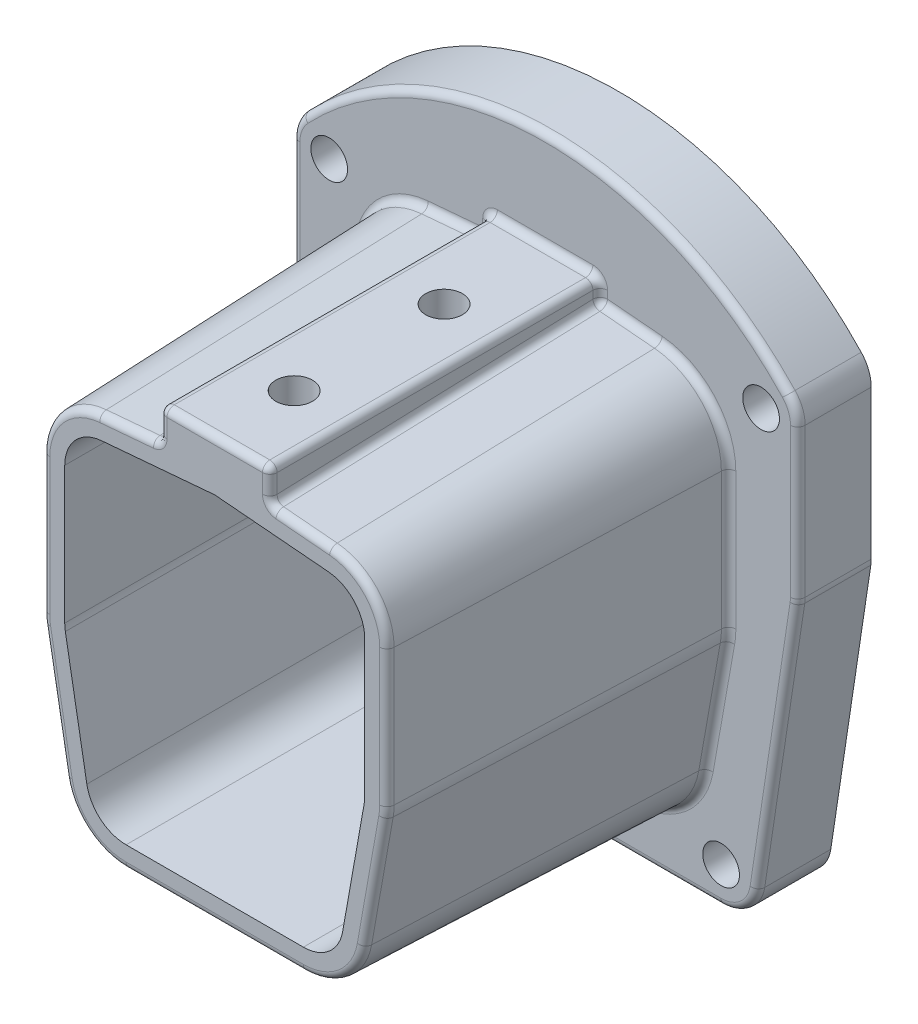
SolidWorks part; units mm, degrees
ref_plane "Plan de face" through (0, 0, 0) normal (0, 0, 1) x (1, 0, 0)
ref_plane "Plan de dessus" through (0, 0, 0) normal (0, 1, 0) x (1, 0, 0)
ref_plane "Plan de droite" through (0, 0, 0) normal (1, 0, 0) x (0, 0, -1)
sketch "Esquisse1" plane through (0, 0, 0) normal (0, 0, 1) x (1, 0, 0)
  line L0 (0, 81.7634) -> (0, -68.113) construction
  line L1 (0, 59.8685) -> (-31.7104, 57.1467)
  line L2 (-50, 37.22) -> (-50, 0)
  line L3 (-49.6934, -3.4884) -> (-43.8355, -36.5581)
  line L4 (-24.1421, -53.0696) -> (24.1421, -53.0696)
  line L5 (49.6934, -3.4884) -> (43.8355, -36.5581)
  line L6 (50, 37.22) -> (50, 0)
  line L7 (0, 59.8685) -> (31.7104, 57.1467)
  arc A0 (-24.1421, -53.0696) -> (-43.8355, -36.5581) centre (-24.1421, -33.0696) cw
  arc A1 (-49.6934, -3.4884) -> (-50, 0) centre (-30, 0) cw
  arc A2 (-50, 37.22) -> (-31.7104, 57.1467) centre (-30, 37.22) cw
  arc A3 (24.1421, -53.0696) -> (43.8355, -36.5581) centre (24.1421, -33.0696) ccw
  arc A4 (49.6934, -3.4884) -> (50, 0) centre (30, 0) ccw
  arc A5 (50, 37.22) -> (31.7104, 57.1467) centre (30, 37.22) ccw
  point P15 (0, -53.0696)
  dimension "D1" = 20
  dimension "D2" = 100
extrude "Boss.-Extru.1" add sketch "Esquisse1" along normal blind 90 draft 2
sketch "Esquisse3" plane through (0, 0, 0) normal (0, 0, -1) x (-1, 0, 0)
  line L0 (0, 91.9147) -> (0, -85.0361) construction
  line L1 (-68.8142, 55.5099) -> (-68.8142, 14.9392)
  line L2 (-68.703, 13.4522) -> (-57.8061, -59.0124)
  line L3 (-47.9173, -67.5253) -> (47.9173, -67.5253)
  line L4 (68.703, 13.4522) -> (57.8061, -59.0124)
  line L5 (68.8142, 55.5099) -> (68.8142, 14.9392)
  arc A0 (66.0866, 62.3737) -> (-66.0866, 62.3737) centre (0, 0) ccw
  arc A1 (-47.9173, -67.5253) -> (-57.8061, -59.0124) centre (-47.9173, -57.5253) cw
  arc A2 (-68.703, 13.4522) -> (-68.8142, 14.9392) centre (-58.8142, 14.9392) cw
  arc A3 (-68.8142, 55.5099) -> (-66.0866, 62.3737) centre (-58.8142, 55.5099) cw
  arc A4 (47.9173, -67.5253) -> (57.8061, -59.0124) centre (47.9173, -57.5253) ccw
  arc A5 (68.703, 13.4522) -> (68.8142, 14.9392) centre (58.8142, 14.9392) ccw
  arc A6 (68.8142, 55.5099) -> (66.0866, 62.3737) centre (58.8142, 55.5099) ccw
  point P16 (0, -67.5253)
  dimension "D1" = 10
extrude "Boss.-Extru.2" add sketch "Esquisse3" along normal blind 20
sketch "Esquisse2" plane through (0, 0, 90) normal (0, 0, 1) x (1, 0, 0)
  line L14 (30.9285, 48.0373) -> (0, 50.692)
  line L15 (0, 50.692) -> (-30.9285, 48.0373)
  line L16 (-40.8571, 37.22) -> (-40.8571, 0)
  line L17 (-40.6907, -1.8937) -> (-34.8328, -34.9633)
  line L18 (-24.1421, -43.9267) -> (24.1421, -43.9267)
  line L19 (34.8328, -34.9633) -> (40.6907, -1.8937)
  line L20 (40.8571, 0) -> (40.8571, 37.22)
  line L21 (30.9285, 48.0373) -> (0, 50.692)
  line L22 (0, 50.692) -> (-30.9285, 48.0373)
  line L23 (-40.8571, 37.22) -> (-40.8571, 0)
  line L24 (-40.6907, -1.8937) -> (-34.8328, -34.9633)
  line L25 (-24.1421, -43.9267) -> (24.1421, -43.9267)
  line L26 (34.8328, -34.9633) -> (40.6907, -1.8937)
  line L27 (40.8571, 0) -> (40.8571, 37.22)
  arc A12 (-30.9285, 48.0373) -> (-40.8571, 37.22) centre (-30, 37.22) ccw
  arc A13 (-40.8571, 0) -> (-40.6907, -1.8937) centre (-30, 0) ccw
  arc A14 (-34.8328, -34.9633) -> (-24.1421, -43.9267) centre (-24.1421, -33.0696) ccw
  arc A15 (24.1421, -43.9267) -> (34.8328, -34.9633) centre (24.1421, -33.0696) ccw
  arc A16 (40.6907, -1.8937) -> (40.8571, 0) centre (30, 0) ccw
  arc A17 (40.8571, 37.22) -> (30.9285, 48.0373) centre (30, 37.22) ccw
  arc A18 (-30.9285, 48.0373) -> (-40.8571, 37.22) centre (-30, 37.22) ccw
  arc A19 (-40.8571, 0) -> (-40.6907, -1.8937) centre (-30, 0) ccw
  arc A20 (-34.8328, -34.9633) -> (-24.1421, -43.9267) centre (-24.1421, -33.0696) ccw
  arc A21 (24.1421, -43.9267) -> (34.8328, -34.9633) centre (24.1421, -33.0696) ccw
  arc A22 (40.6907, -1.8937) -> (40.8571, 0) centre (30, 0) ccw
  arc A23 (40.8571, 37.22) -> (30.9285, 48.0373) centre (30, 37.22) ccw
  dimension "D1" = 6
extrude "Enlèv. mat.-Extru.1" cut sketch "Esquisse2" against normal through all
sketch "Esquisse4" plane through (0, 0, 0) normal (0, 0, 1) x (1, 0, 0)
  line L0 (0, 74.0796) -> (0, 37.9955) construction
  line L1 (-15, 64.4407) -> (15, 64.4407)
  line L2 (-15, 64.4407) -> (-15, 53.0717)
  line L3 (-15, 53.0717) -> (15, 53.0717)
  line L4 (15, 64.4407) -> (15, 53.0717)
  dimension "D1" = 30
  dimension "D2" = 15
extrude "Boss.-Extru.3" add sketch "Esquisse4" along normal up to surface (90 mm away)
fillet "Congé1" radius 2 48 edges at (15, 61.5108, 0) (-15, 59.9336, 90) (15, 59.9336, 90) (0, 64.4407, 0) (-23.3552, 57.8638, 0) (-23.2208, 54.7209, 90) (-44.7344, 50.7439, 0) (-42.419, 48.6187, 90) (-50, 18.61, 0) (-46.8571, 18.61, 90) (-49.9232, -1.7509, 0) (-46.7924, -1.4758, 90) (-46.7645, -20.0233, 0) (-43.6698, -19.4751, 90) (-36.9918, -48.3956, 0) (-34.9726, -45.9872, 90) (0, -53.0696, 0) (0, -49.9267, 90) (36.9918, -48.3956, 0) (34.9726, -45.9872, 90) (46.7645, -20.0233, 0) (43.6698, -19.4751, 90) (49.9232, -1.7509, 0) (46.7924, -1.4758, 90) (50, 18.61, 0) (46.8571, 18.61, 90) (23.2208, 54.7209, 90) (23.3552, 57.8638, 0) (44.7344, 50.7439, 0) (-68.1073, 59.2028, 0) (-68.8142, 35.2245, 0) (-68.7864, 14.1936, 0) (-63.2546, -22.7801, 0) (-54.4414, -65.1039, 0) (0, -67.5253, 0) (54.4414, -65.1039, 0) (63.2546, -22.7801, 0) (68.7864, 14.1936, 0) (68.8142, 35.2245, 0) (68.1073, 59.2028, 0) (-15, 61.5108, 0) (0, 64.4407, 90) (-15, 64.4407, 45) (15, 64.4407, 45) (42.419, 48.6187, 90) (15, 57.0038, 45) (-15, 57.0038, 45) (0, 90.8731, 0)
hole_wizard "Diamètre du perçage Ø10.0 (10)1" positions "Esquisse6" profile "Esquisse5" hole size "Ø10.0" standard "ISO"
sketch "Esquisse6" plane through (0, 64.4407, 0) normal (0, 1, 0) x (-1, 0, 0)
  line L0 (0, -9.3675) -> (0, 93.9565) construction
  point P0 (0, 27.5431)
  point P1 (0, 68.3733)
sketch "Esquisse5" plane through (0, 64.4407, 27.5431) normal (1, 0, 0) x (0, 0, 1)
  line L0 (0, 0) -> (0, 56.7543)
  line L1 (0, 56.7543) -> (5, 53.75)
  line L2 (5, 53.75) -> (5, 0)
  line L5 (5, 0) -> (0, 0)
  line L10 (0, 56.7543) -> (-5, 53.75) construction
  line L11 (0, -6.35) -> (0, 107.95) construction
  dimension "Diamètre du perçage" = 10
  dimension "Profondeur du perçage" = 53.75
  dimension "Angle de pointe" = 118
hole_wizard "Diamètre du perçage Ø10.0 (10)2" positions "Esquisse8" profile "Esquisse7" hole size "Ø10.0" standard "ISO"
sketch "Esquisse8" plane through (0, 0, 0) normal (0, 0, 1) x (1, 0, 0)
  arc A0 (-66.0866, 62.3737) -> (-68.8142, 55.5099) centre (-58.8142, 55.5099) ccw construction
  arc A1 (-57.8061, -59.0124) -> (-47.9173, -67.5253) centre (-47.9173, -57.5253) ccw construction
  point P0 (-47.9173, -57.5253)
  point P1 (-58.8142, 55.5099)
sketch "Esquisse7" plane through (-47.9173, -57.5253, 0) normal (1, 0, 0) x (0, -1, 0)
  line L0 (0, 0) -> (0, 20.001)
  line L1 (0, 20.001) -> (5, 20.001)
  line L2 (5, 20.001) -> (5, 0)
  line L5 (5, 0) -> (0, 0)
  line L11 (0, -6.35) -> (0, 107.95) construction
  dimension "Diamètre du perçage jusqu'au prochain" = 10
  dimension "Profondeur du perçage jusqu'au prochain" = 20.001
mirror "Symétrie1" about plane through (0, 0, 0) normal (1, 0, 0) of "Diamètre du perçage Ø10.0 (10)2"
sketch "Esquisse9" plane through (0, 0, -20) normal (0, 0, -1) x (-1, 0, 0)
  line L0 (-15, -56.979) -> (15, -56.979) construction
  line L1 (-15, -50.979) -> (15, -50.979)
  line L2 (-15, -62.979) -> (15, -62.979)
  line L3 (0, 96.076) -> (0, -73.7169) construction
  line L4 (-53.2406, -5.2035) -> (-47.7694, -34.7003) construction
  line L5 (-47.3412, -4.1092) -> (-41.87, -33.6061)
  line L6 (-59.14, -6.2977) -> (-53.6688, -35.7946)
  line L7 (-56.0381, 43.5136) -> (-56.0381, 13.5136) construction
  line L8 (-50.0381, 43.5136) -> (-50.0381, 13.5136)
  line L9 (-62.0381, 43.5136) -> (-62.0381, 13.5136)
  line L10 (-41.7189, 63.9909) -> (-12.8834, 72.2682) construction
  line L11 (-43.3744, 69.758) -> (-14.5389, 78.0353)
  line L12 (-40.0634, 58.2238) -> (-11.2279, 66.5011)
  line L13 (53.2406, -5.2035) -> (47.7694, -34.7003) construction
  line L14 (47.3412, -4.1092) -> (41.87, -33.6061)
  line L15 (59.14, -6.2977) -> (53.6688, -35.7946)
  line L16 (56.0381, 43.5136) -> (56.0381, 13.5136) construction
  line L17 (50.0381, 43.5136) -> (50.0381, 13.5136)
  line L18 (62.0381, 43.5136) -> (62.0381, 13.5136)
  line L19 (41.7189, 63.9909) -> (12.8834, 72.2682) construction
  line L20 (43.3744, 69.758) -> (14.5389, 78.0353)
  line L21 (40.0634, 58.2238) -> (11.2279, 66.5011)
  arc A0 (-15, -50.979) -> (-15, -62.979) centre (-15, -56.979) ccw
  arc A1 (15, -62.979) -> (15, -50.979) centre (15, -56.979) ccw
  arc A2 (-47.3412, -4.1092) -> (-59.14, -6.2977) centre (-53.2406, -5.2035) ccw
  arc A3 (-53.6688, -35.7946) -> (-41.87, -33.6061) centre (-47.7694, -34.7003) ccw
  arc A4 (-50.0381, 43.5136) -> (-62.0381, 43.5136) centre (-56.0381, 43.5136) ccw
  arc A5 (-62.0381, 13.5136) -> (-50.0381, 13.5136) centre (-56.0381, 13.5136) ccw
  arc A6 (-43.3744, 69.758) -> (-40.0634, 58.2238) centre (-41.7189, 63.9909) ccw
  arc A7 (-11.2279, 66.5011) -> (-14.5389, 78.0353) centre (-12.8834, 72.2682) ccw
  arc A8 (47.3412, -4.1092) -> (59.14, -6.2977) centre (53.2406, -5.2035) cw
  arc A9 (53.6688, -35.7946) -> (41.87, -33.6061) centre (47.7694, -34.7003) cw
  arc A10 (50.0381, 43.5136) -> (62.0381, 43.5136) centre (56.0381, 43.5136) cw
  arc A11 (62.0381, 13.5136) -> (50.0381, 13.5136) centre (56.0381, 13.5136) cw
  arc A12 (43.3744, 69.758) -> (40.0634, 58.2238) centre (41.7189, 63.9909) cw
  arc A13 (11.2279, 66.5011) -> (14.5389, 78.0353) centre (12.8834, 72.2682) cw
  point P2 (0, -56.979)
  point P12 (-50.505, -19.9519)
  point P19 (-56.0381, 28.5136)
  point P26 (-27.3011, 68.1295)
  point P33 (50.505, -19.9519)
  point P40 (56.0381, 28.5136)
  point P47 (27.3011, 68.1295)
  dimension "D1" = 6
  dimension "D2" = 30
  dimension "D3" = 6
  dimension "D4" = 6
  dimension "D5" = 6
  dimension "D6" = 30
  dimension "D7" = 30
  dimension "D8" = 30
extrude "Enlèv. mat.-Extru.2" cut sketch "Esquisse9" against normal blind 14
fillet "Congé2" radius 2 28 edges at (50.0381, 28.5136, -6) (56.0381, 7.5136, -6) (62.0381, 28.5136, -6) (56.0381, 49.5136, -6) (44.6056, -18.8577, -6) (46.6751, -40.5997, -6) (56.4044, -21.0461, -6) (54.3348, 0.6959, -6) (0, -50.979, -6) (-21, -56.979, -6) (0, -62.979, -6) (21, -56.979, -6) (-56.4044, -21.0461, -6) (-46.6751, -40.5997, -6) (-44.6056, -18.8577, -6) (-54.3348, 0.6959, -6) (-62.0381, 28.5136, -6) (-56.0381, 7.5136, -6) (-50.0381, 28.5136, -6) (-56.0381, 49.5136, -6) (-25.6457, 62.3624, -6) (-7.1163, 73.9237, -6) (-28.9566, 73.8966, -6) (-47.486, 62.3354, -6) (28.9566, 73.8966, -6) (7.1163, 73.9237, -6) (25.6457, 62.3624, -6) (47.486, 62.3354, -6)
